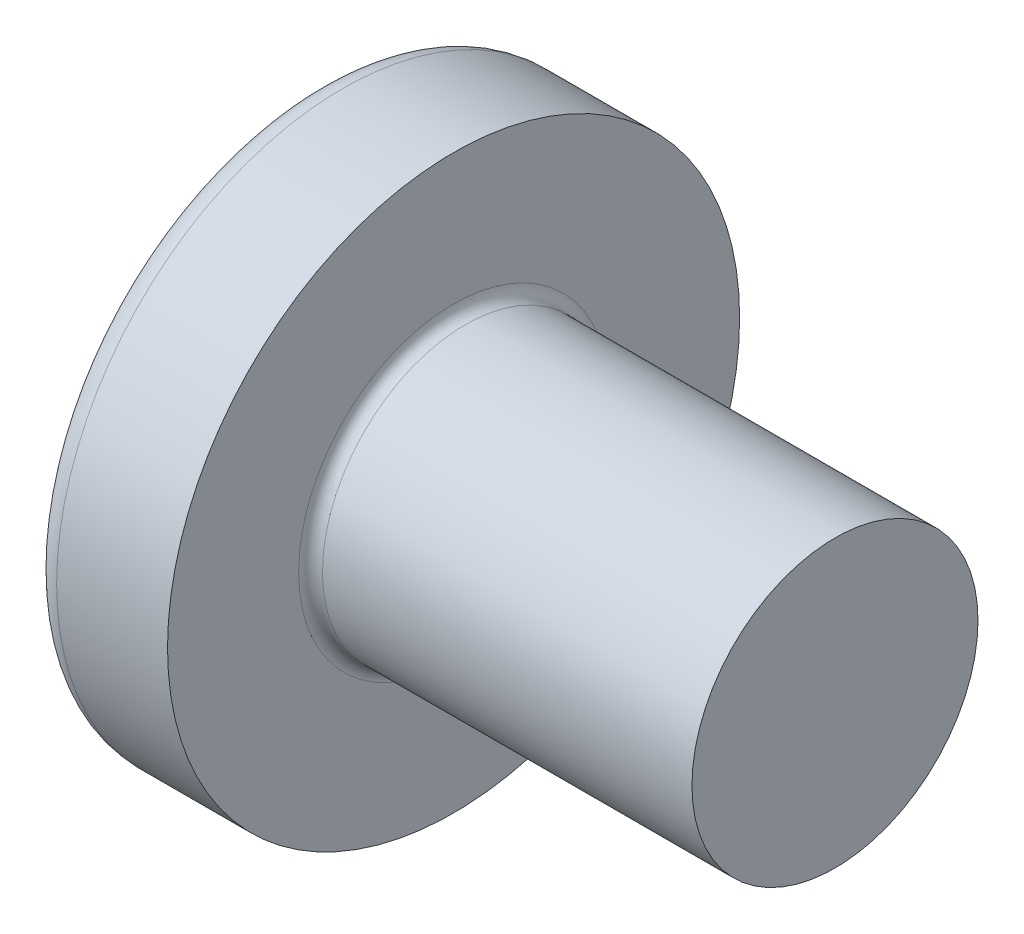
SolidWorks part; units mm, degrees
ref_plane "Plane1" through (0, 0, 0) normal (0, 0, 1) x (1, 0, 0)
ref_plane "Plane2" through (0, 0, 0) normal (0, 1, 0) x (1, 0, 0)
ref_plane "Plane3" through (0, 0, 0) normal (1, 0, 0) x (0, 0, -1)
revolve "Base-Revolve" add sketch "BodySke"
sketch "BodySke" plane through (0, 0, 0) normal (0, 0, 1) x (1, 0, 0)
  line L0 (4.6, 3) -> (4.6, 6)
  line L1 (5.1, 6.35) -> (5.1, -3.175) construction
  line L2 (-25.4, 0) -> (127, 0) construction
  line L3 (12.6, 0) -> (0, 0)
  line L4 (4.6, 3) -> (12.6, 3)
  line L5 (12.6, 3) -> (12.6, 0)
  line L6 (2.2747, 6) -> (4.6, 6)
  line L8 (4.6, 6.35) -> (4.6, -3.175) construction
  arc A0 (1.8337, 5.7717) -> (0, 0) centre (10, 0) ccw
  arc A2 (1.8337, 5.7717) -> (2.2747, 6) centre (2.2747, 5.46) cw
  dimension "Head_fillet_rad" = 0.54
  dimension "Head_crown_rad" = 10
  dimension "Head_ht" = 4.6
  dimension "Diameter" = 6
  dimension "Length" = 8
  dimension "Head_dia" = 12
  dimension "Advance" = 1
  dimension "Thread_nom" = 8
fillet "Fillet1" radius 0.25 1 edges at (4.6, 0, 3)
sketch "Sketch3" plane through (0, 0, 0) normal (1, 0, 0) x (0, 0, -1)
  line L0 (0.71, -3.35) -> (-0.71, -3.35)
  line L1 (0.71, -3.35) -> (0.71, 3.35)
  line L2 (-0.71, 3.35) -> (0.71, 3.35)
  line L3 (-0.71, 3.35) -> (-0.71, -3.35)
  dimension "D1" = 3.35
  dimension "Cross_dia" = 6.7
  dimension "D2" = 0.71
  dimension "Cross_width" = 1.42
ref_plane "Plane4" through (3.46, 0, 0) normal (1, 0, 0) x (0, 0, -1)
sketch "Sketch4" plane through (3.46, 0, 0) normal (1, 0, 0) x (0, 0, -1)
  line L0 (0.71, -1.6249) -> (-0.71, -1.6249)
  line L1 (0.71, -1.6249) -> (0.71, 1.6249)
  line L2 (-0.71, 1.6249) -> (0.71, 1.6249)
  line L3 (-0.71, 1.6249) -> (-0.71, -1.6249)
  dimension "D1" = 1.42
  dimension "D2" = 3.2498
  dimension "D3" = 0.71
  dimension "D4" = 1.6249
loft "Recess" cut profiles "Sketch3", "Sketch4"
pattern_circular "RecPat" count 2 every 90 about axis through (0, 0, 0) along (1, 0, 0) of "Recess"
sketch "RecCorSke" plane through (0, 0, 0) normal (0, 0, 1) x (1, 0, 0)
  line L0 (-3.175, 0) -> (15.875, 0) construction
  line L1 (-25.4, 0) -> (127, 0) construction
  line L2 (0, 0) -> (0, 1.5224)
  line L3 (0, 1.5224) -> (3.46, 1.2805)
  line L4 (3.46, 1.2805) -> (3.8761, 0)
  line L5 (3.8761, 0) -> (0, 0)
  dimension "Diameter" = 2.561
  dimension "Depth" = 3.46
  dimension "Draft_angle" = 4
  dimension "Bottom_angle" = 18
revolve "RecessCore" cut sketch "RecCorSke" angle 360 about L0
sketch "ThdSchSke" plane through (0, 0, 0) normal (0, 0, 1) x (1, 0, 0)
  line L0 (6.6, -2.4455) -> (6.2117, -3)
  line L1 (6.6, -2.4455) -> (6.9883, -3)
  line L2 (6.9883, -3) -> (6.9883, -3.75)
  line L3 (-3.175, 0) -> (5.1513, 0) construction
  line L5 (6.9883, -3.75) -> (6.2117, -3.75)
  line L6 (6.2117, -3.75) -> (6.2117, -3)
  dimension "Thread_minor" = 4.891
  dimension "Diameter" = 6
  dimension "Start" = 6.6
  dimension "SideAngle" = 55
  dimension "VeeAngle" = 70
  dimension "Overcut" = 7.5
revolve "ThreadSchematic" [suppressed] cut sketch "ThdSchSke" angle 360 about L3
pattern_linear "ThdSchPat" [suppressed]
chamfer "Chanfrein1" [suppressed] distance 0.5 angle 45
equation "\"D1@Sketch3\" = \"Cross_dia@Sketch3\" / 2"
equation "\"D2@Sketch3\" = \"Cross_width@Sketch3\" / 2"
equation "\"Depth@RecCorSke\" = \"Cross_depth@Plane4\""
equation "\"D1@Sketch4\" = \"Cross_width@Sketch3\""
equation "\"D2@Sketch4\" = \"Cross_dia@Sketch3\" - 2.0 * \"Cross_depth@Plane4\" * tan(26.5  * 0.017453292)"
equation "\"D3@Sketch4\" = \"D1@Sketch4\" / 2"
equation "\"D4@Sketch4\" = \"D2@Sketch4\" / 2"
equation "\"Thread_length@ThreadCosmetic\" = ((sgn( (\"Length@BodySke\" - \"Advance@BodySke\" * 2.0 ) - \"Thread_nom@BodySke\" )-1)*( (\"Length@BodySke\" - \"Advance@BodySke\" * 2.0 ) - \"Thread_nom@BodySke\" ))/-2+ \"Thread_"
equation "\"Thread_minor@ThdSchSke\" = \"Thread_minor@ThreadCosmetic\""
equation "\"Diameter@ThdSchSke\" = \"Diameter@BodySke\""
equation "\"Overcut@ThdSchSke\" = \"Diameter@BodySke\" * 1.25"
equation "\"Start@ThdSchSke\" = \"Head_ht@BodySke\" + \"Length@BodySke\" - \"Thread_length@ThreadCosmetic\"  '---Non-countersunk---"
equation "\"Num_threads@ThdSchPat\" = int( \"Thread_length@ThreadCosmetic\" / \"Advance@BodySke\" + 0.999 )  + 1"
equation "\"Advance@ThdSchPat\" = \"Thread_length@ThreadCosmetic\" /  (\"Num_threads@ThdSchPat\" - 1) 'relax it"
